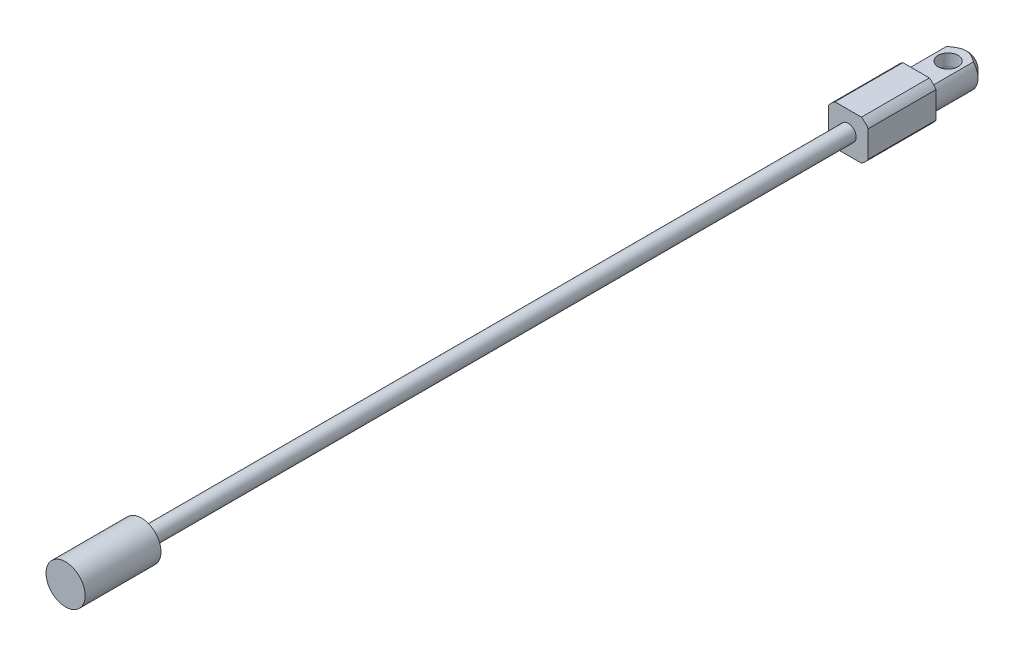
SolidWorks part; units mm, degrees
ref_plane "Front Plane" through (0, 0, 0) normal (0, 0, 1) x (1, 0, 0)
ref_plane "Top Plane" through (0, 0, 0) normal (0, 1, 0) x (1, 0, 0)
ref_plane "Right Plane" through (0, 0, 0) normal (1, 0, 0) x (0, 0, -1)
sketch "Sketch1" plane through (0, 0, 0) normal (0, 0, 1) x (1, 0, 0)
  line L0 (-67.4741, 0) -> (88.6984, 0) construction
  circle A0 centre (0, 0) radius 5.715
  dimension "D1" = 11.43
extrude "Extrude1" add sketch "Sketch1" along normal blind 16.51
sketch "Sketch2" plane through (0, 0, 16.51) normal (0, 0, 1) x (1, 0, 0)
  line L0 (-12.6652, 0) -> (12.8799, 0) construction
  line L1 (-4.2121, 6.35) -> (4.2121, 6.35)
  line L2 (-6.35, 4.2121) -> (-6.35, -4.2121)
  line L3 (-4.2121, -6.35) -> (4.2121, -6.35)
  line L4 (6.35, 4.2121) -> (6.35, -4.2121)
  line L5 (0, 10.9121) -> (0, -10.0177) construction
  arc A0 (6.35, 4.2121) -> (4.2121, 6.35) centre (0, 0) ccw
  arc A1 (4.2121, -6.35) -> (6.35, -4.2121) centre (0, 0) ccw
  arc A2 (-6.35, -4.2121) -> (-4.2121, -6.35) centre (0, 0) ccw
  arc A3 (-4.2121, 6.35) -> (-6.35, 4.2121) centre (0, 0) ccw
  dimension "D1" = 15.24
  dimension "D2" = 6.35
  dimension "D3" = 6.35
extrude "Extrude2" add sketch "Sketch2" along normal blind 21.59
sketch "Sketch3" plane through (0, 0, 38.1) normal (0, 0, 1) x (1, 0, 0)
  circle A0 centre (0, 0) radius 2.54
  dimension "D1" = 5.08
extrude "Extrude3" add sketch "Sketch3" along normal blind 224.79
sketch "Sketch4" plane through (0, 0, 262.89) normal (0, 0, 1) x (1, 0, 0)
  circle A0 centre (0, 0) radius 6.223
  dimension "D1" = 12.446
extrude "Extrude4" add sketch "Sketch4" along normal blind 24.13
chamfer "Chamfer1" distance 2.54 angle 45 1 edges at (5.715, 0, 0)
sketch "Sketch5" plane through (0, 0, 0) normal (1, 0, 0) x (0, 0, -1)
  line L0 (-16.51, 4.2121) -> (-16.51, 6.35) construction
  line L1 (-16.51, 3.81) -> (4.8802, 3.81)
  line L2 (-16.51, 3.81) -> (-16.51, 10.0404)
  line L3 (-16.51, 10.0404) -> (4.8802, 10.0404)
  line L4 (4.8802, 10.0404) -> (4.8802, 3.81)
  line L5 (-17.8838, 0) -> (0, 0) construction
  dimension "D1" = 3.81
extrude "Cut-Extrude1" cut sketch "Sketch5" along normal through all and the other way through all
mirror "Mirror1" about plane through (0, 0, 0) normal (0, 1, 0) of "Cut-Extrude1"
sketch "Sketch6" plane through (0, 3.81, 0) normal (0, 1, 0) x (-1, 0, 0)
  circle A0 centre (0, 6.35) radius 3.175
  dimension "D1" = 6.35
  dimension "D2" = 6.35
extrude "Cut-Extrude2" cut sketch "Sketch6" against normal through all
sketch "Sketch7" plane through (0, -3.81, 0) normal (0, -1, 0) x (1, 0, 0)
  circle A0 centre (0, 6.35) radius 3.175 construction
  point P0 (0, 6.35)
sketch "Sketch8" plane through (0, 0, 0) normal (1, 0, 0) x (0, 0, -1)
  line L0 (0, 0) -> (-10.9196, 0)
ref_point "Point1"
